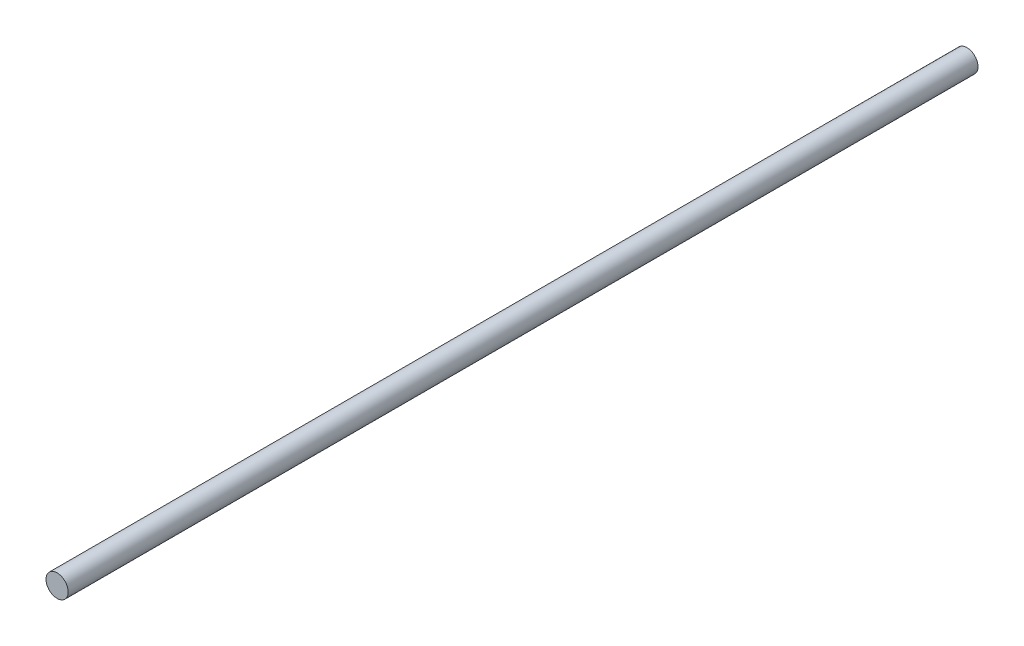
SolidWorks part; units mm, degrees
ref_plane "Front Plane" through (0, 0, 0) normal (0, 0, 1) x (1, 0, 0)
ref_plane "Top Plane" through (0, 0, 0) normal (0, 1, 0) x (1, 0, 0)
ref_plane "Right Plane" through (0, 0, 0) normal (1, 0, 0) x (0, 0, -1)
sketch "Croquis1" plane through (0, 0, 0) normal (1, 0, 0) x (0, 0, -1)
  line L0 (-226.7983, 0) -> (226.7983, 0) construction
  line L2 (-205, 0) -> (205, 0)
  line L3 (-205, 0) -> (-205, 5)
  line L4 (-205, 5) -> (205, 5)
  line L5 (205, 0) -> (205, 5)
  point P4 (0, 0)
  point P9 (0, 0)
  dimension "D1" = 410
  dimension "D2" = 10
revolve "Revolución1" add sketch "Croquis1" angle 360 about L0
